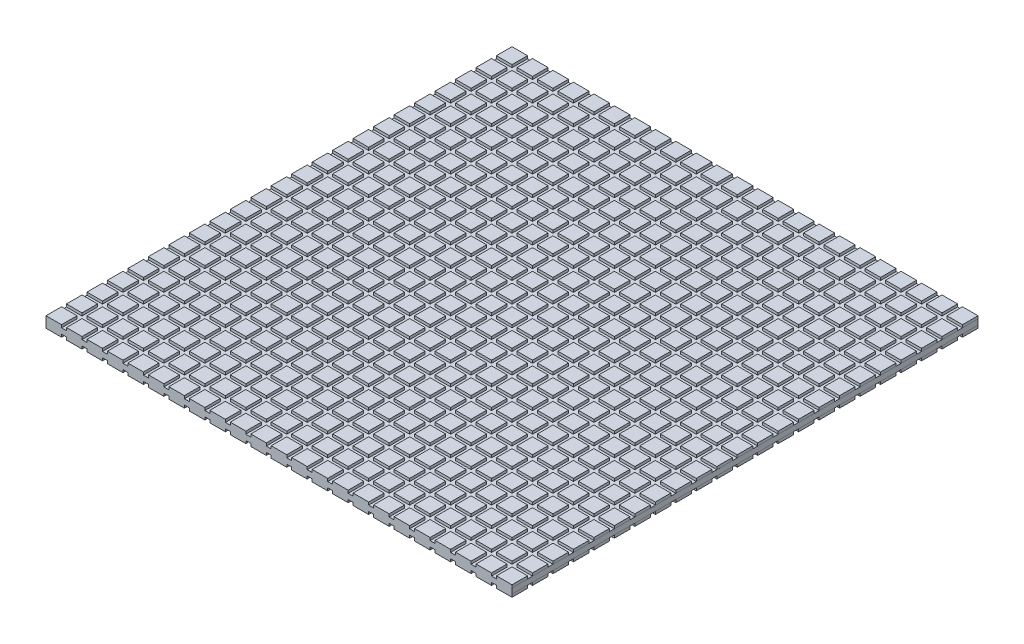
SolidWorks part; units mm, degrees
ref_plane "Front Plane" through (0, 0, 0) normal (0, 0, 1) x (1, 0, 0)
ref_plane "Top Plane" through (0, 0, 0) normal (0, 1, 0) x (1, 0, 0)
ref_plane "Right Plane" through (0, 0, 0) normal (1, 0, 0) x (0, 0, -1)
sketch "Sketch1" plane through (0, 0, 0) normal (0, 1, 0) x (1, 0, 0)
  line L1 (150, -150) -> (-150, -150)
  line L2 (150, -150) -> (150, 150)
  line L3 (150, 150) -> (-150, 150)
  line L4 (-150, -150) -> (-150, 150)
  line L5 (150, -150) -> (-150, 150) construction
  line L6 (150, 150) -> (-150, -150) construction
  point P0 (0, 0)
  dimension "D1" = 300
extrude "Boss-Extrude1" add sketch "Sketch1" along normal mid plane 3.5
sketch "Sketch2" plane through (0, 0, 0) normal (0, 1, 0) x (1, 0, 0)
  line L0 (-150, 150) -> (-150, -150) construction
  line L1 (-150, -150) -> (-140, -150)
  line L2 (-150, -150) -> (-150, -140)
  line L3 (-150, -140) -> (-140, -140)
  line L4 (-140, -150) -> (-140, -140)
  line L5 (-150, -150) -> (-140, -140) construction
  line L6 (-150, -140) -> (-140, -150) construction
  line L7 (-150, -150) -> (150, -150) construction
  point P0 (-145, -145)
  dimension "D1" = 10
extrude "Boss-Extrude2" add sketch "Sketch2" along normal mid plane 7
pattern_linear "LPattern4" count 23 spacing 13.1818 along (0, 0, -1) of "Boss-Extrude2"
pattern_linear "LPattern5" count 23 spacing 13.1818 along (1, 0, 0) of "LPattern4", "Boss-Extrude2"
